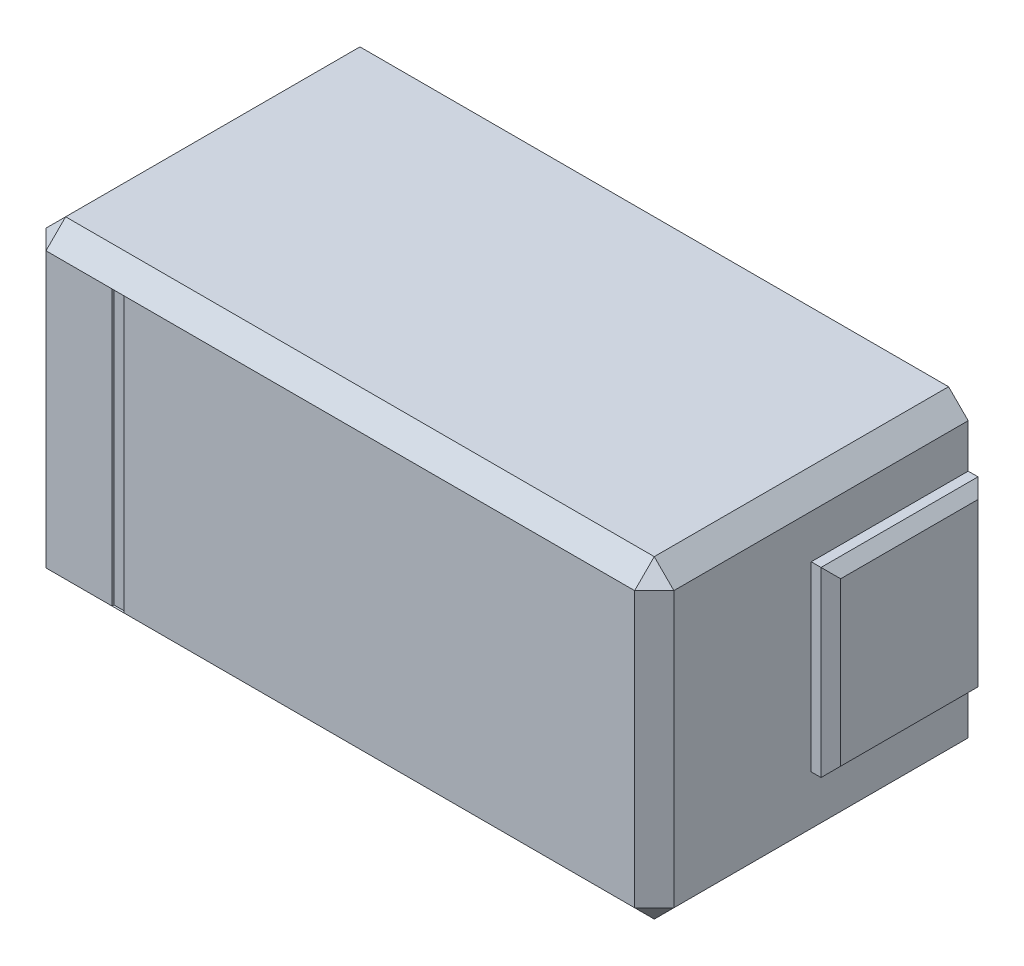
SolidWorks part; units mm, degrees
ref_plane "Plane1" through (0, 0, 0) normal (0, 0, 1) x (1, 0, 0)
ref_plane "Plane2" through (0, 0, 0) normal (0, 1, 0) x (1, 0, 0)
ref_plane "Plane3" through (0, 0, 0) normal (1, 0, 0) x (0, 0, -1)
sketch "Sketch1" plane through (0, 0, 0) normal (0, 0, 1) x (1, 0, 0)
  line L0 (0, 0) -> (3.2, 0)
  line L1 (0, 0) -> (0, 1.6)
  line L2 (3.2, 1.6) -> (0, 1.6)
  line L3 (3.2, 1.6) -> (3.2, 0)
  dimension "D1" = 3.2
  dimension "D2" = 1.6
extrude "Base-Extrude" add sketch "Sketch1" along normal blind 1.6
sketch "Sketch2" plane through (0, 0, 0) normal (-1, 0, 0) x (0, 0, 1)
  line L0 (0, 0) -> (0, 1.6) construction
  line L1 (0, 1.3) -> (0.75, 1.3)
  line L2 (0, 1.3) -> (0, 0.3)
  line L3 (0, 0.3) -> (0.75, 0.3)
  line L4 (0.75, 1.3) -> (0.75, 0.3)
extrude "Boss-Extrude1" add sketch "Sketch2" along normal blind 0.1
sketch "Sketch3" plane through (3.2, 0, 0) normal (1, 0, 0) x (0, 0, -1)
  line L0 (0, 1.6) -> (0, 0) construction
  line L1 (0, 1.2773) -> (-0.8, 1.2773)
  line L2 (0, 1.2773) -> (0, 0.35)
  line L3 (0, 0.35) -> (-0.8, 0.35)
  line L4 (-0.8, 1.2773) -> (-0.8, 0.35)
extrude "Boss-Extrude2" add sketch "Sketch3" along normal blind 0.1
chamfer "Chamfer1" distance 0.1 angle 45
chamfer "Chamfer2" distance 0.05 angle 45
sketch "Sketch4" plane through (0, 0, 1.6) normal (0, 0, 1) x (1, 0, 0)
  line L0 (0.1, 0.1) -> (3.1, 0.1) construction
  line L1 (0.4363, 0.1) -> (0.4988, 0.1)
  line L2 (0.4363, 0.1) -> (0.4363, 1.5)
  line L3 (0.4363, 1.5) -> (0.4988, 1.5)
  line L4 (0.4988, 0.1) -> (0.4988, 1.5)
  line L5 (3.1, 1.5) -> (0.1, 1.5) construction
extrude "Cut-Extrude1" cut sketch "Sketch4" against normal blind 0.01
